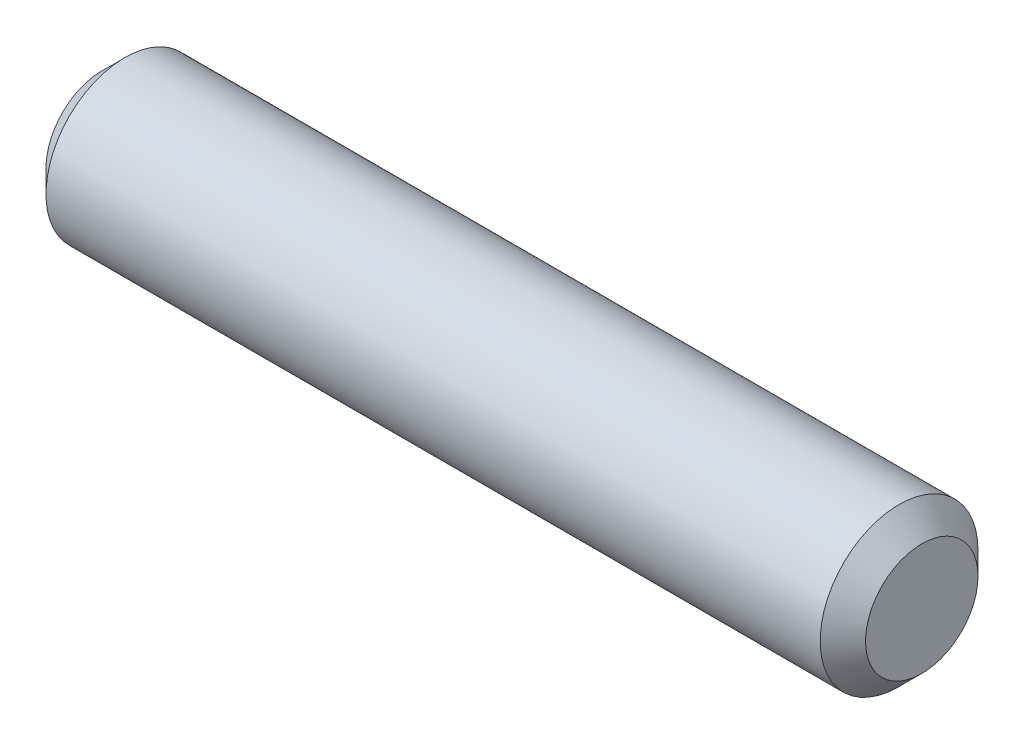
SolidWorks part; units mm, degrees
ref_plane "Front Plane" through (0, 0, 0) normal (0, 0, 1) x (1, 0, 0)
ref_plane "Top Plane" through (0, 0, 0) normal (0, 1, 0) x (1, 0, 0)
ref_plane "Right Plane" through (0, 0, 0) normal (1, 0, 0) x (0, 0, -1)
sketch "Sketch1" plane through (0, 0, 0) normal (1, 0, 0) x (0, 0, -1)
  circle A0 centre (0, 0) radius 3.9738
  dimension "D1" = 7.9477
extrude "Boss-Extrude1" add sketch "Sketch1" along normal mid plane 41.275
chamfer "Chamfer1" distance 1.143 angle 45 2 edges at (-20.6375, 0, -3.9738) (20.6375, 0, -3.9738)
